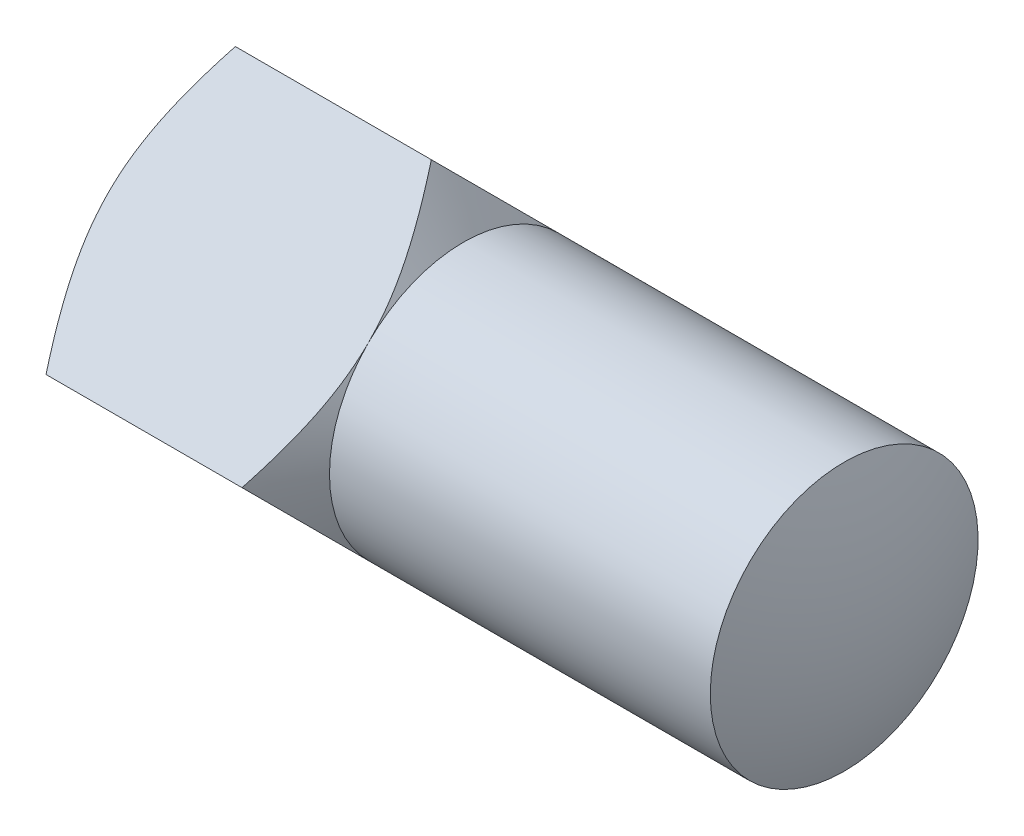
SolidWorks part; units mm, degrees
ref_plane "Front Plane" through (0, 0, 0) normal (0, 0, 1) x (1, 0, 0)
ref_plane "Top Plane" through (0, 0, 0) normal (0, 1, 0) x (1, 0, 0)
ref_plane "Right Plane" through (0, 0, 0) normal (1, 0, 0) x (0, 0, -1)
sketch "BaseHeadSke" plane through (0, 0, 0) normal (1, 0, 0) x (0, 0, -1)
  line L0 (0, 0) -> (14.1701, 0) construction
  line L1 (0, 0) -> (0, 11.9761) construction
  line L2 (0, 2.8284) -> (2.8284, 0)
  line L3 (0, -2.8284) -> (2.8284, 0)
  line L4 (0, 2.8284) -> (-2.8284, 0)
  line L5 (0, -2.8284) -> (-2.8284, 0)
  dimension "Width_flats" = 4
  dimension "Angle" = 45
extrude "BaseHead" add sketch "BaseHeadSke" along normal blind 4
sketch "HeadChamferSke" plane through (0, 0, 0) normal (0, 0, 1) x (1, 0, 0)
  line L0 (0, 0) -> (6.1973, 0) construction
  line L1 (2, 2.8284) -> (2, -3.5627) construction
  line L2 (4, 2.8284) -> (0, 2.8284) construction
  line L3 (0, 2.8284) -> (0, 1.9)
  line L4 (0, 2.8284) -> (0.536, 2.8284)
  line L5 (0.536, 2.8284) -> (0, 1.9)
  line L6 (0, 2.8284) -> (0, 0) construction
  line L7 (3.464, 2.8284) -> (4, 1.9)
  line L8 (4, 2.8284) -> (3.464, 2.8284)
  line L9 (4, 2.8284) -> (4, 1.9)
  dimension "Head_chamfer" = 3.8
  dimension "Angle" = 30
revolve "HeadChamfer" cut sketch "HeadChamferSke" angle 360 about L0
sketch "BodySke" plane through (0, 0, 0) normal (0, 0, 1) x (1, 0, 0)
  line L0 (0, 0) -> (13.1857, 0) construction
  line L1 (4, -1.9) -> (4, 1.9) construction
  line L2 (4, 0) -> (4, 1.9) construction
  line L3 (3.464, 2) -> (9.6307, 2)
  line L4 (10, 2) -> (10, 0) construction
  line L5 (4, 1.9) -> (4, 2) construction
  line L6 (3.464, 2) -> (3.464, 0)
  line L7 (3.464, 0) -> (10, 0)
  line L8 (9.6307, 2) -> (9.6307, -2) construction
  line L9 (10, 2) -> (9.6307, 2) construction
  line L10 (9.3, 2.6461) -> (9.3, -2) construction
  arc A0 (9.6307, 2) -> (10, 0) centre (4.4, 0) cw
  point P15 (3.464, 1.61)
  dimension "RoundedEnd" = 5.6
  dimension "Diameter" = 4
  dimension "Length" = 6
  dimension "Minor_dia" = 3.22
  dimension "Advance" = 0.7
revolve "BaseBody" add sketch "BodySke" angle 360 about L0
sketch "ThdSchSke" plane through (0, 0, 0) normal (0, 0, 1) x (1, 0, 0)
  line L0 (8.9307, 2.4503) -> (8.9307, 2)
  line L1 (8.9307, 2.4503) -> (9.381, 2.4503)
  line L2 (9.381, 2.4503) -> (9.381, 2)
  line L3 (9.381, 2) -> (9.1558, 1.61)
  line L4 (9.1558, 1.61) -> (8.9307, 2)
  line L5 (0, 0) -> (11.8711, 0) construction
  line L8 (9.6307, 2) -> (3.9423, 2) construction
  dimension "D1" = 0.7
revolve "ThreadSchematic" [suppressed] cut sketch "ThdSchSke" angle 360 about L5
pattern_linear "ThdSchPat" [suppressed] count 7
equation "\"Minor_dia@ThreadCosmetic\" = \"Minor_dia@BodySke\""
equation "\"D1@ThdSchSke\" = \"Advance@BodySke\""
equation "\"Advance@ThdSchPat\" = \"Advance@BodySke\""
equation "\"D1@ThdSchPat\" =  int( \"Length@BodySke\" / \"Advance@ThdSchPat\" )  - 1"
